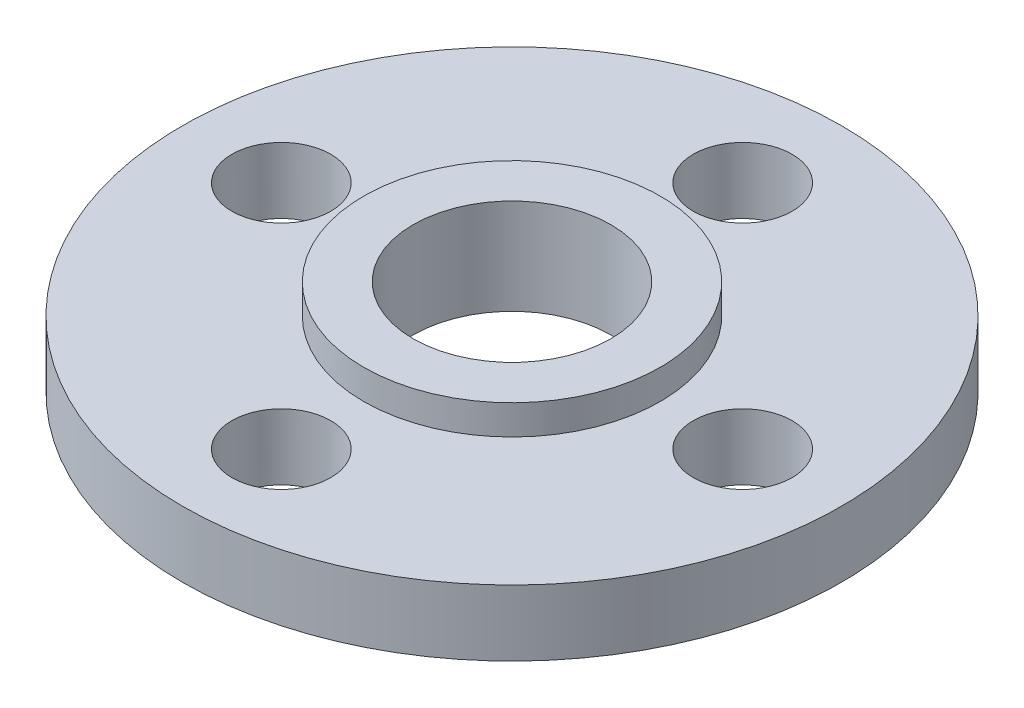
SolidWorks part; units mm, degrees
ref_plane "Front Plane" through (0, 0, 0) normal (0, 0, 1) x (1, 0, 0)
ref_plane "Top Plane" through (0, 0, 0) normal (0, 1, 0) x (1, 0, 0)
ref_plane "Right Plane" through (0, 0, 0) normal (1, 0, 0) x (0, 0, -1)
sketch "Sketch2" plane through (0, 0, 0) normal (0, 1, 0) x (1, 0, 0)
  circle A0 centre (0, 0) radius 10
  dimension "D1" = 20
extrude "Boss-Extrude1" add sketch "Sketch2" along normal blind 2
sketch "Sketch3" plane through (0, 2, 0) normal (0, 1, 0) x (1, 0, 0)
  circle A0 centre (0, 0) radius 4.5
  dimension "D1" = 9
extrude "Boss-Extrude2" add sketch "Sketch3" along normal blind 0.9
sketch "Sketch4" plane through (0, 0, 0) normal (0, -1, 0) x (1, 0, 0)
  line L0 (0, 0) -> (0, 7) construction
  circle A0 centre (0, 0) radius 3
  circle A1 centre (0, 7) radius 1.5
  circle A2 centre (7, 0) radius 1.5
  circle A3 centre (0, -7) radius 1.5
  circle A4 centre (-7, 0) radius 1.5
  circle A5 centre (0, 0) radius 10 construction
  point P14 (0, 0)
  dimension "D1" = 6
  dimension "D3" = 3
  dimension "D2" = 7
  dimension "D4" = 4
extrude "Cut-Extrude1" cut sketch "Sketch4" against normal blind 3.9
